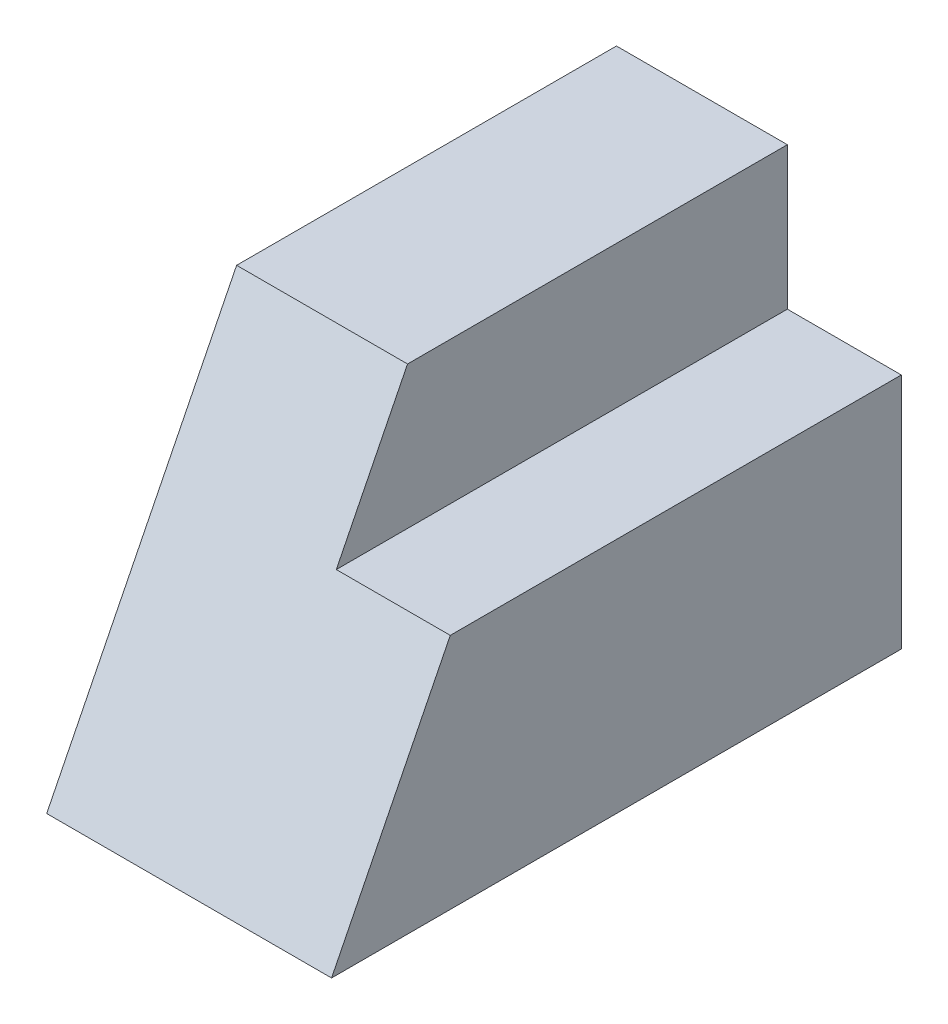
SolidWorks part; units mm, degrees
ref_plane "前视基准面" through (0, 0, 0) normal (0, 0, 1) x (1, 0, 0)
ref_plane "上视基准面" through (0, 0, 0) normal (0, 1, 0) x (1, 0, 0)
ref_plane "右视基准面" through (0, 0, 0) normal (1, 0, 0) x (0, 0, -1)
sketch "草图1" plane through (0, 0, 0) normal (0, 1, 0) x (1, 0, 0)
  line L1 (-15, -30) -> (15, -30)
  line L2 (-15, -30) -> (-15, 30)
  line L3 (-15, 30) -> (15, 30)
  line L4 (15, -30) -> (15, 30)
  line L5 (-15, -30) -> (15, 30) construction
  line L6 (-15, 30) -> (15, -30) construction
  point P0 (0, 0)
  dimension "D1" = 30
  dimension "D2" = 60
extrude "凸台-拉伸1" add sketch "草图1" along normal blind 40
sketch "草图2" plane through (15, 0, 0) normal (1, 0, 0) x (0, 0, -1)
  line L0 (-30, 0) -> (-10, 40)
  line L1 (-30, 40) -> (30, 40) construction
  line L2 (-10, 40) -> (-30, 40)
  line L3 (-30, 40) -> (-30, 0)
  dimension "D1" = 20
extrude "切除-拉伸1" cut sketch "草图2" against normal blind 50
sketch "草图3" plane through (0, 0, -30) normal (0, 0, -1) x (-1, 0, 0)
  line L0 (-15, 40) -> (-15, 25)
  line L1 (-15, 40) -> (-15, 0) construction
  line L2 (-15, 25) -> (-3, 25)
  line L3 (-3, 25) -> (-3, 40)
  line L4 (-15, 40) -> (15, 40) construction
  line L5 (-3, 40) -> (-15, 40)
  dimension "D1" = 12
  dimension "D2" = 15
extrude "切除-拉伸2" cut sketch "草图3" against normal blind 50
